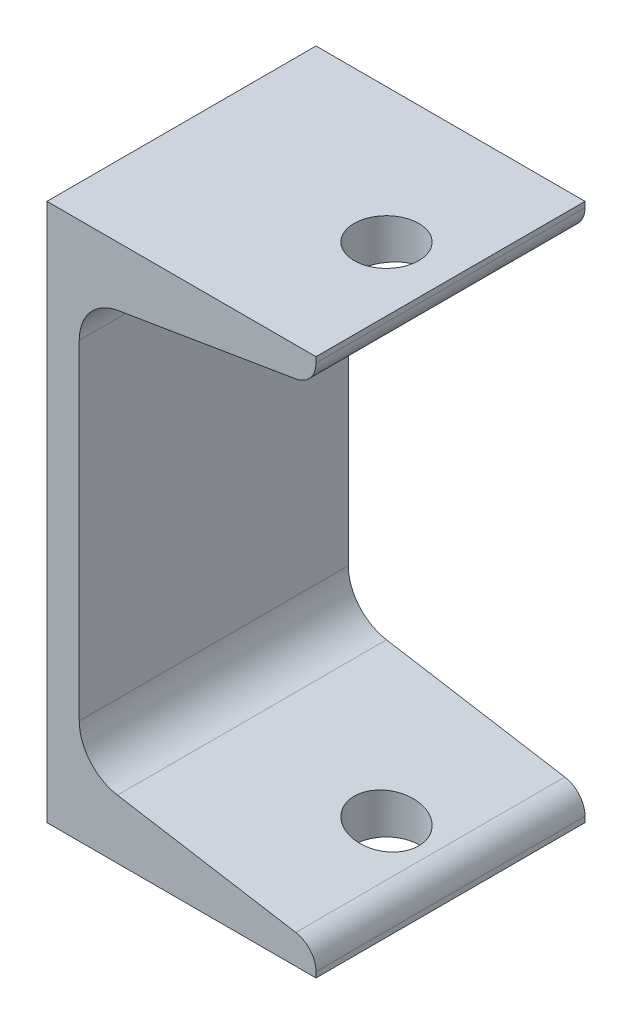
SolidWorks part; units mm, degrees
ref_plane "Plane1" through (0, 0, 0) normal (0, 0, 1) x (1, 0, 0)
ref_plane "Plane2" through (0, 0, 0) normal (0, 1, 0) x (-1, 0, 0)
ref_plane "Plane3" through (0, 0, 0) normal (1, 0, 0) x (0, 0, -1)
extrude "BaseMchannel" add sketch "Sketch1" along normal mid plane 50
sketch "Sketch1" plane through (0, 0, 0) normal (0, 0, 1) x (1, 0, 0)
  line L0 (50, 100) -> (0, 100)
  line L1 (50, 0) -> (0, 0)
  line L2 (0, 100) -> (0, 0)
  line L3 (7.8492, 0) -> (-7.8492, 0) construction
  line L4 (0, -15.6984) -> (0, 15.6984) construction
  line L5 (0, 8.5) -> (89.0016, 8.5) construction
  line L6 (50, 100) -> (50, 95.1669)
  line L7 (50, 0) -> (50, 4.8331)
  line L12 (6, 80.6326) -> (6, 19.3674)
  line L17 (13.1025, 89.0169) -> (50, 95.1669)
  line L18 (13.1025, 10.9831) -> (50, 4.8331)
  arc A9 (6, 19.3674) -> (13.1025, 10.9831) centre (14.5, 19.3674) ccw
  arc A10 (6, 80.6326) -> (13.1025, 89.0169) centre (14.5, 80.6326) cw
  dimension "RI" = 8.5
  dimension "D2" = 9.463
  dimension "D3" = 19.3674
  dimension "Depth" = 100
  dimension "BF" = 50
  dimension "TW" = 6
  dimension "TF" = 8.5
  dimension "d1" = 61.2651
fillet "ToeFillet" radius 4.5 2 edges at (50, 4.8331, 0) (50, 95.1669, 0)
sketch "Skizze1" plane through (0, 0, 0) normal (0, -1, 0) x (1, 0, 0)
  circle A0 centre (38.1, 0) radius 6
  dimension "D1" = 12
extrude "Schnitt-Linear austragen1" cut sketch "Skizze1" against normal through all
equation "\"d1@Sketch1\" = \"Depth@Sketch1\" - 2*\"TF@Sketch1\" -  2*( \"RI@Sketch1\" * cos(\"D2@Sketch1\"/180*3.141592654))-2*((((\"BF@Sketch1\"-\"TW@Sketch1\")/2)-(\"RI@Sketch1\"-\"RI@Sketch1\"*sin(\"D2@Sketch1\"/180*3.141592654"
equation "\"D3@Sketch1\" =  ( \"Depth@Sketch1\" - \"d1@Sketch1\" )  / 2"
